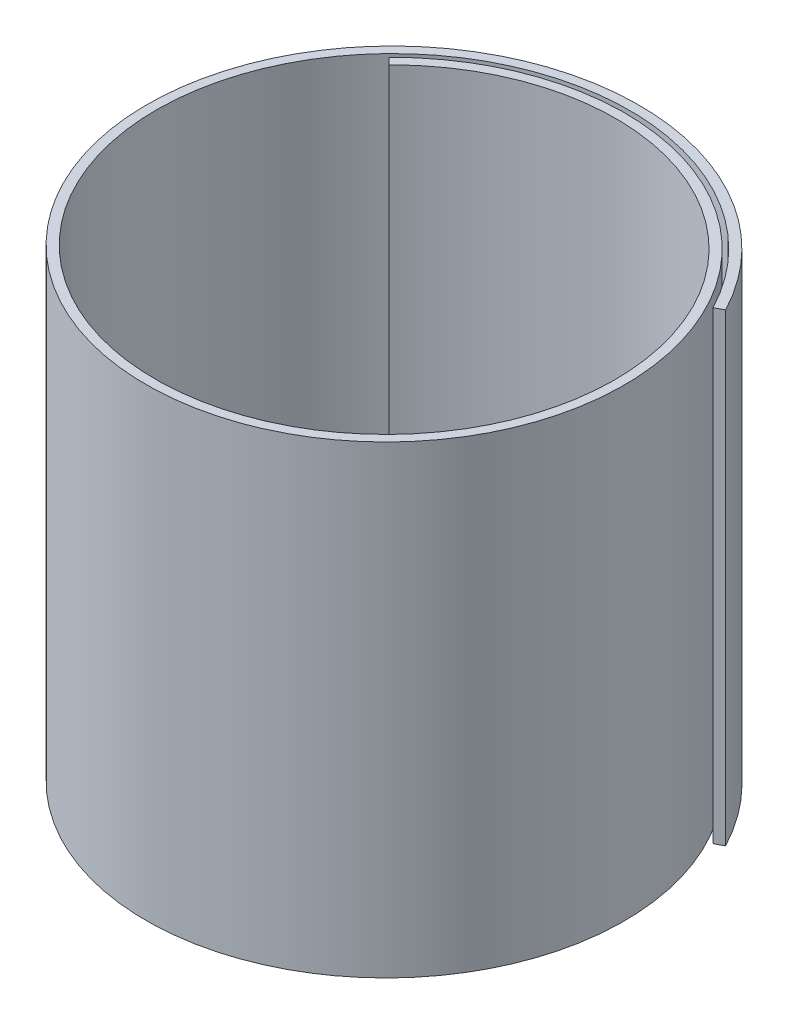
SolidWorks part; units mm, degrees
ref_plane "Vorne" through (0, 0, 0) normal (0, 0, 1) x (1, 0, 0)
ref_plane "Oben" through (0, 0, 0) normal (0, 1, 0) x (1, 0, 0)
ref_plane "Rechts" through (0, 0, 0) normal (1, 0, 0) x (0, 0, -1)
sketch "Skizze2" plane through (0, 0, 0) normal (0, 1, 0) x (1, 0, 0)
  circle A0 centre (0, 0) radius 50
  dimension "D1" = 100
curve "Spirale/Helix1"
sketch "Skizze3" plane through (0, 0, 0) normal (0, 1, 0) x (1, 0, 0)
  point P0 (-35.3553, 35.3553)
  point P1 (48.0253, 24.4701)
  dimension "D1" = 0
ref_plane "Ebene1" through (0, 100, 0) normal (0, 1, 0) x (-1, 0, 0)
sketch "Skizze4" plane through (0, 100, 0) normal (0, 1, 0) x (-1, 0, 0)
  point P0 (35.3553, -35.3553)
  point P1 (-48.0253, -24.4701)
sheet metal parameters "Blech1" thickness 2 parameters "D1"=30, "Dicke"=2
lofted bend "Ausgeformte Biegungen1" parameters "D1"=0, "D12"=2
other "Freiform-Biegung1" parameters "D1"=1000, "D4"=57.296, "D5"=1
flat pattern "Abwicklung1"
sketch "Biegung-Linien1" plane through (0, 0, 0) normal (0, 1, 0) x (-1, 0, 0)
other "Abwickeln-<Freiform-Biegung1>1"
